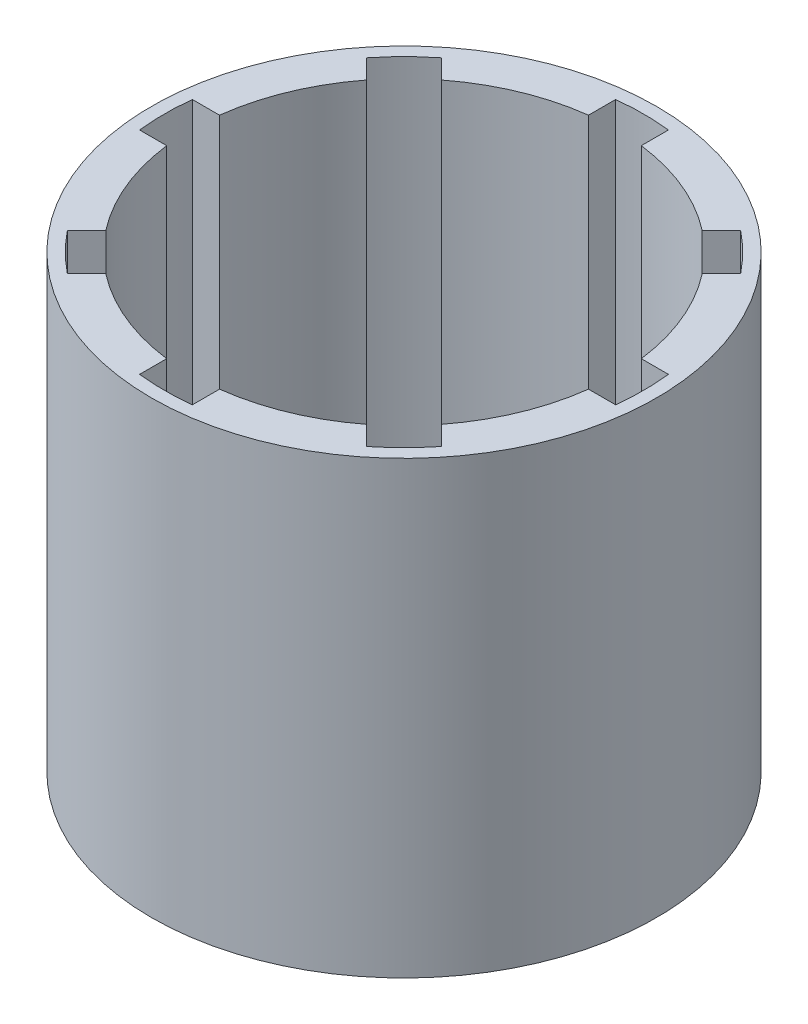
SolidWorks part; units mm, degrees
ref_plane "Plan de face" through (0, 0, 0) normal (0, 0, 1) x (1, 0, 0)
ref_plane "Plan de dessus" through (0, 0, 0) normal (0, 1, 0) x (1, 0, 0)
ref_plane "Plan de droite" through (0, 0, 0) normal (1, 0, 0) x (0, 0, -1)
sketch "Esquisse1" plane through (0, 0, 0) normal (0, 1, 0) x (1, 0, 0)
  circle A0 centre (0, 0) radius 50.5
  circle A1 centre (0, 0) radius 42.5
  dimension "D1" = 101
  dimension "D2" = 85
extrude "Extrusion1" add sketch "Esquisse1" along normal blind 90
sketch "Esquisse2" plane through (0, 90, 0) normal (0, 1, 0) x (1, 0, 0)
  line L0 (0, -53.0282) -> (0, 55.423) construction
  line L1 (5.2798, 47.6045) -> (5.2798, 26.8562)
  line L2 (5.2798, 26.8562) -> (-5.2798, 26.8562)
  line L3 (-5.2798, 47.6045) -> (-5.2798, 26.8562)
  line L4 (29.9281, 37.3948) -> (15.2568, 22.7236)
  line L5 (37.3948, 29.9281) -> (22.7236, 15.2568)
  line L6 (22.7236, 15.2568) -> (15.2568, 22.7236)
  line L7 (47.6045, 5.2798) -> (26.8562, 5.2798)
  line L8 (47.6045, -5.2798) -> (26.8562, -5.2798)
  line L9 (26.8562, -5.2798) -> (26.8562, 5.2798)
  line L10 (37.3948, -29.9281) -> (22.7236, -15.2568)
  line L11 (29.9281, -37.3948) -> (15.2568, -22.7236)
  line L12 (15.2568, -22.7236) -> (22.7236, -15.2568)
  line L13 (5.2798, -47.6045) -> (5.2798, -26.8562)
  line L14 (-5.2798, -47.6045) -> (-5.2798, -26.8562)
  line L15 (-5.2798, -26.8562) -> (5.2798, -26.8562)
  line L16 (-29.9281, -37.3948) -> (-15.2568, -22.7236)
  line L17 (-37.3948, -29.9281) -> (-22.7236, -15.2568)
  line L18 (-22.7236, -15.2568) -> (-15.2568, -22.7236)
  line L19 (-47.6045, -5.2798) -> (-26.8562, -5.2798)
  line L20 (-47.6045, 5.2798) -> (-26.8562, 5.2798)
  line L21 (-26.8562, 5.2798) -> (-26.8562, -5.2798)
  line L22 (-37.3948, 29.9281) -> (-22.7236, 15.2568)
  line L23 (-29.9281, 37.3948) -> (-15.2568, 22.7236)
  line L24 (-15.2568, 22.7236) -> (-22.7236, 15.2568)
  arc A0 (-5.2798, 47.6045) -> (5.2798, 47.6045) centre (0, 0) cw
  arc A1 (29.9281, 37.3948) -> (37.3948, 29.9281) centre (0, 0) cw
  arc A2 (47.6045, 5.2798) -> (47.6045, -5.2798) centre (0, 0) cw
  arc A3 (37.3948, -29.9281) -> (29.9281, -37.3948) centre (0, 0) cw
  arc A4 (5.2798, -47.6045) -> (-5.2798, -47.6045) centre (0, 0) cw
  arc A5 (-29.9281, -37.3948) -> (-37.3948, -29.9281) centre (0, 0) cw
  arc A6 (-47.6045, -5.2798) -> (-47.6045, 5.2798) centre (0, 0) cw
  arc A7 (-37.3948, 29.9281) -> (-29.9281, 37.3948) centre (0, 0) cw
  point P9 (0, 26.8562)
extrude "Enlèv. mat.-Extru.1" cut sketch "Esquisse2" against normal blind 90
